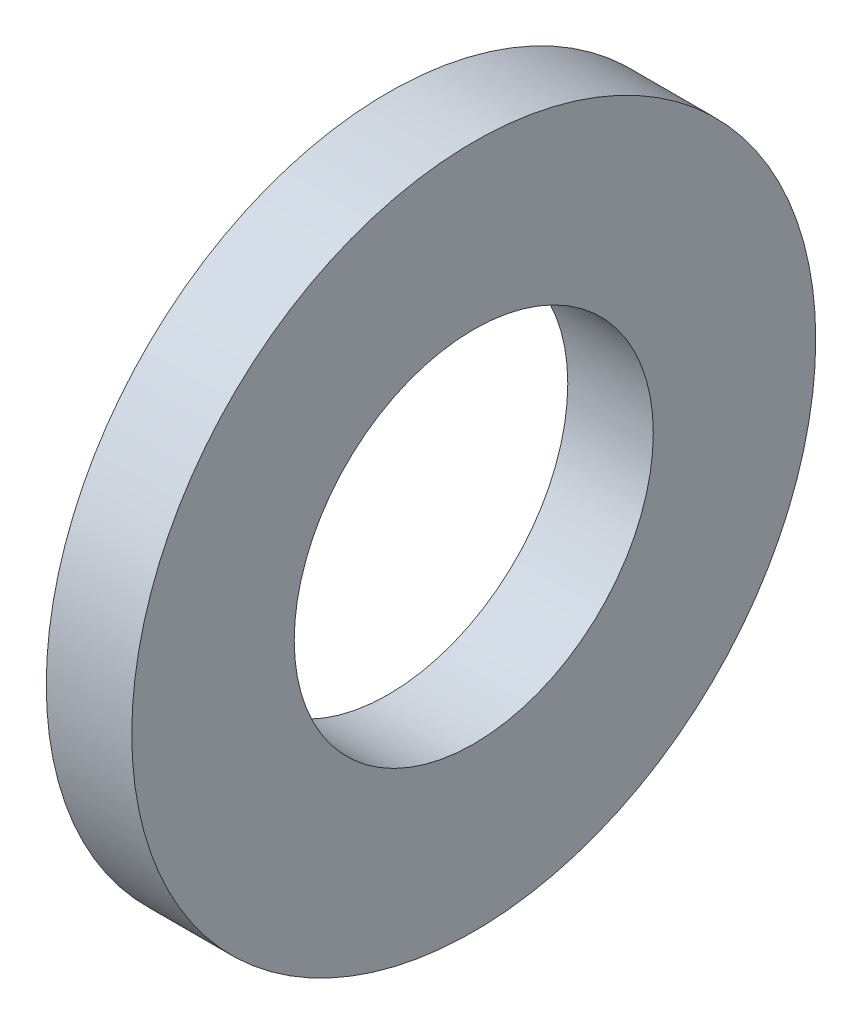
SolidWorks part; units mm, degrees
ref_plane "Plan de face" through (0, 0, 0) normal (0, 0, 1) x (1, 0, 0)
ref_plane "Plan de dessus" through (0, 0, 0) normal (0, 1, 0) x (1, 0, 0)
ref_plane "Plan de droite" through (0, 0, 0) normal (1, 0, 0) x (0, 0, -1)
sketch "Esquisse2" plane through (0, 0, 0) normal (0, 0, 1) x (1, 0, 0)
  line L0 (-7.4558, 0) -> (12.2905, 0) construction
  line L1 (2, 4.2) -> (2, 8)
  line L2 (2, 8) -> (0, 8)
  line L3 (0, 8) -> (0, 4.2)
  line L4 (0, 4.2) -> (2, 4.2)
  dimension "D1" = 8
  dimension "D2" = 4.2
  dimension "Thickness" = 2
revolve "Révolution1" add sketch "Esquisse2" angle 360 about L0
